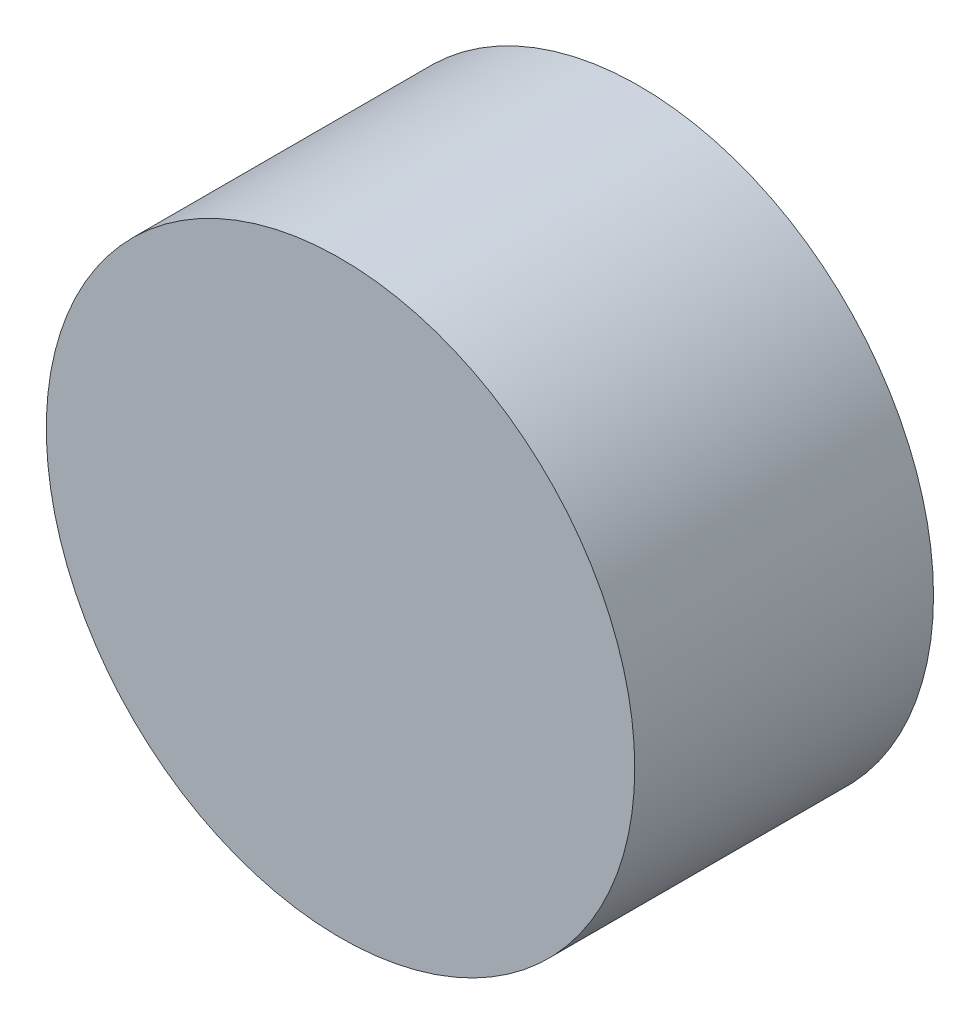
SolidWorks part; units mm, degrees
other "DetailItem1"
extrude "Base-Extrude" add sketch "Sketch1" along normal blind 33
sketch "Sketch1" plane through (0, 0, 0) normal (0, 0, 1) x (1, 0, 0)
  circle A0 centre (0, 0) radius 32.5
  dimension "D1" = 65
ref_plane "Plane1" through (0, 0, 0) normal (0, 0, 1) x (1, 0, 0)
ref_plane "Plane2" through (0, 0, 0) normal (0, 1, 0) x (1, 0, 0)
ref_plane "Plane3" through (0, 0, 0) normal (1, 0, 0) x (0, 0, -1)
